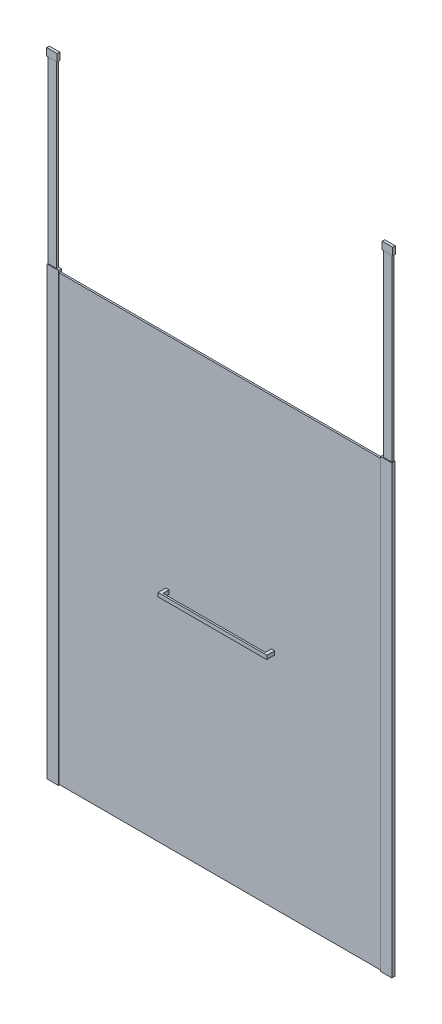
SolidWorks part; units mm, degrees
ref_plane "Płaszczyzna przednia" through (0, 0, 0) normal (0, 0, 1) x (1, 0, 0)
ref_plane "Płaszczyzna górna" through (0, 0, 0) normal (0, 1, 0) x (1, 0, 0)
ref_plane "Płaszczyzna prawa" through (0, 0, 0) normal (1, 0, 0) x (0, 0, -1)
sketch "Szkic1" plane through (0, 0, 0) normal (0, 1, 0) x (1, 0, 0)
  line L0 (0, 0) -> (0, 14)
  line L1 (0, 14) -> (53, 14)
  line L2 (53, 14) -> (53, 11)
  line L3 (53, 11) -> (42.9, 11)
  line L4 (42.9, 11) -> (42.9, 3)
  line L5 (42.9, 3) -> (53, 3)
  line L6 (53, 3) -> (53, 0)
  line L7 (53, 0) -> (0, 0)
  dimension "D1" = 53
  dimension "D2" = 14
  dimension "D3" = 10.1
  dimension "D4" = 3
  dimension "D5" = 8
extrude "Dodanie-wyciągnięcie1" add sketch "Szkic1" along normal blind 2100 from offset 3
sketch "Szkic2" plane through (0, 3, 0) normal (0, -1, 0) x (1, 0, 0)
  line L0 (42.9, -11) -> (53, -11) construction
  line L1 (42.9, -3) -> (1589.9, -3)
  line L2 (42.9, -3) -> (42.9, -11)
  line L3 (42.9, -11) -> (1589.9, -11)
  line L4 (1589.9, -3) -> (1589.9, -11)
  dimension "D1" = 1547
extrude "Dodanie-wyciągnięcie2" add sketch "Szkic2" against normal blind 2100 separate body
sketch "Szkic3" plane through (0, 3, 0) normal (0, -1, 0) x (1, 0, 0)
  line L0 (1579.8, -3) -> (1579.8, 0)
  line L1 (1589.9, -3) -> (42.9, -3) construction
  line L2 (1579.8, 0) -> (1632.8, 0)
  line L3 (1632.8, 0) -> (1632.8, -14)
  line L4 (1632.8, -14) -> (1579.8, -14)
  line L5 (1579.8, -14) -> (1579.8, -11)
  line L6 (1579.8, -11) -> (1589.9, -11)
  line L7 (1589.9, -11) -> (1589.9, -3)
  line L8 (1589.9, -3) -> (1579.8, -3)
  line L9 (42.9, -11) -> (1589.9, -11) construction
  line L10 (1589.9, -11) -> (1589.9, -3) construction
  dimension "D1" = 10.1
  dimension "D2" = 3
  dimension "D3" = 3
  dimension "D4" = 53
extrude "Dodanie-wyciągnięcie3" add sketch "Szkic3" against normal blind 2108 separate body
sketch "Szkic4" plane through (0, 2103, 0) normal (0, 1, 0) x (1, 0, 0)
  line L1 (0, 14) -> (53, 14)
  line L2 (0, 14) -> (0, 0)
  line L3 (0, 0) -> (53, 0)
  line L4 (53, 14) -> (53, 0)
extrude "Dodanie-wyciągnięcie4" add sketch "Szkic4" along normal blind 11
sketch "Szkic5" plane through (0, 2111, 0) normal (0, 1, 0) x (1, 0, 0)
  line L1 (1632.8, 14) -> (1579.8, 14)
  line L2 (1632.8, 14) -> (1632.8, 0)
  line L3 (1632.8, 0) -> (1579.8, 0)
  line L4 (1579.8, 14) -> (1579.8, 0)
extrude "Dodanie-wyciągnięcie5" add sketch "Szkic5" along normal blind 3
sketch "Szkic6" plane through (1579.8, 0, 0) normal (-1, 0, 0) x (0, 0, 1)
  line L0 (-11, 2111) -> (-3, 2111) construction
  line L1 (-2.95, 2111) -> (-11.05, 2111)
  line L2 (-2.95, 2111) -> (-2.95, 2103.2)
  line L3 (-2.95, 2103.2) -> (-11.05, 2103.2)
  line L4 (-11.05, 2111) -> (-11.05, 2103.2)
  point P6 (-7, 2111)
  dimension "D1" = 8.1
  dimension "D2" = 7.8
extrude "Dodanie-wyciągnięcie6" add sketch "Szkic6" against normal blind 15
sketch "Szkic7" plane through (0, 3, 0) normal (0, -1, 0) x (1, 0, 0)
  line L1 (1579.8, 0) -> (1632.8, 0)
  line L2 (1579.8, 0) -> (1579.8, -14)
  line L3 (1579.8, -14) -> (1632.8, -14)
  line L4 (1632.8, 0) -> (1632.8, -14)
extrude "Dodanie-wyciągnięcie7" add sketch "Szkic7" along normal blind 3
sketch "Szkic8" plane through (0, 3, 0) normal (0, -1, 0) x (1, 0, 0)
  line L1 (0, 0) -> (53, 0)
  line L2 (0, 0) -> (0, -14)
  line L3 (0, -14) -> (53, -14)
  line L4 (53, 0) -> (53, -14)
extrude "Dodanie-wyciągnięcie8" add sketch "Szkic8" along normal blind 3
sketch "Szkic9" plane through (0, 2114, 2099.6) normal (0, -1, 0) x (-1, 0, 0)
  line L0 (0, 2113.6) -> (0, 2099.6) construction
  line L1 (-1631.3, 2110.6) -> (-1591.3, 2110.6)
  line L2 (-1631.3, 2110.6) -> (-1631.3, 2102.6)
  line L3 (-1631.3, 2102.6) -> (-1591.3, 2102.6)
  line L4 (-1591.3, 2110.6) -> (-1591.3, 2102.6)
  line L5 (-1.5, 2102.6) -> (-41.5, 2102.6)
  line L6 (-1.5, 2102.6) -> (-1.5, 2110.6)
  line L7 (-1579.8, 2113.6) -> (-1632.8, 2113.6) construction
  line L8 (-1632.8, 2113.6) -> (-1632.8, 2099.6) construction
  line L9 (-1.5, 2110.6) -> (-41.5, 2110.6)
  line L10 (-41.5, 2102.6) -> (-41.5, 2110.6)
  line L11 (-53, 2113.6) -> (0, 2113.6) construction
  dimension "D1" = 3
  dimension "D2" = 1.5
  dimension "D3" = 8
  dimension "D4" = 40
  dimension "D5" = 1.5
  dimension "D6" = 40
  dimension "D7" = 3
  dimension "D8" = 8
extrude "Dodanie-wyciągnięcie9" add sketch "Szkic9" against normal blind 883 separate body
sketch "Szkic10" plane through (0, 2997, 0) normal (0, 1, 0) x (-1, 0, 0)
  line L0 (-1591.3, -3) -> (-1591.3, -11) construction
  line L1 (-1636.3, -0.75) -> (-1586.3, -0.75)
  line L2 (-1636.3, -0.75) -> (-1636.3, -13.25)
  line L3 (-1636.3, -13.25) -> (-1586.3, -13.25)
  line L4 (-1586.3, -0.75) -> (-1586.3, -13.25)
  line L5 (-1636.3, -0.75) -> (-1586.3, -13.25) construction
  line L6 (-1636.3, -13.25) -> (-1586.3, -0.75) construction
  line L8 (-1611.3, -7) -> (-1631.3, -7) construction
  line L9 (-1631.3, -11) -> (-1631.3, -3) construction
  line L10 (-21.5, -11) -> (-21.5, -7) construction
  line L11 (3.5, -13.25) -> (-46.5, -13.25)
  line L12 (3.5, -13.25) -> (3.5, -0.75)
  line L13 (3.5, -0.75) -> (-46.5, -0.75)
  line L14 (-46.5, -13.25) -> (-46.5, -0.75)
  line L15 (3.5, -13.25) -> (-46.5, -0.75) construction
  line L16 (3.5, -0.75) -> (-46.5, -13.25) construction
  line L17 (-1.5, -11) -> (-41.5, -11) construction
  line L18 (-21.5, -7) -> (-1.5, -7) construction
  line L19 (-1.5, -3) -> (-1.5, -11) construction
  point P0 (-1611.3, -7)
  point P9 (-21.5, -7)
  dimension "D1" = 12.5
  dimension "D2" = 50
  dimension "D3" = 50
  dimension "D4" = 12.5
  dimension "D5" = 5
extrude "Dodanie-wyciągnięcie10" add sketch "Szkic10" along normal blind 35 from offset 32
ref_plane "Płaszczyzna1" through (1611.3, 0, 0) normal (1, 0, 0) x (0, 0, -1)
sketch "Szkic12" plane through (0, 0, -3) normal (0, 0, 1) x (1, 0, 0)
  line L0 (816.4, 1409.7928) -> (816.4, 762.3594) construction
  line L1 (566.4, 1053) -> (1066.4, 1053) construction
  line L2 (42.9, 2103) -> (42.9, 3) construction
  line L3 (1589.9, 2103) -> (1589.9, 3) construction
  line L5 (558.9, 1062) -> (573.9, 1062)
  line L6 (558.9, 1062) -> (558.9, 1044)
  line L7 (558.9, 1044) -> (573.9, 1044)
  line L8 (573.9, 1062) -> (573.9, 1044)
  line L9 (558.9, 1062) -> (573.9, 1044) construction
  line L10 (558.9, 1044) -> (573.9, 1062) construction
  line L11 (1058.9, 1062) -> (1073.9, 1062)
  line L12 (1058.9, 1062) -> (1058.9, 1044)
  line L13 (1058.9, 1044) -> (1073.9, 1044)
  line L14 (1073.9, 1062) -> (1073.9, 1044)
  line L15 (1058.9, 1062) -> (1073.9, 1044) construction
  line L16 (1058.9, 1044) -> (1073.9, 1062) construction
  dimension "D1" = 1053
  dimension "D2" = 500
  dimension "D3" = 15
  dimension "D4" = 18
extrude "Dodanie-wyciągnięcie11" add sketch "Szkic12" along normal blind 36.5 and the other way blind 18 separate body
sketch "Szkic13" plane through (573.9, 0, 0) normal (1, 0, 0) x (0, 0, -1)
  line L0 (21, 1044) -> (-33.5, 1044) construction
  line L1 (-33.5, 1062) -> (-25.5, 1062)
  line L2 (-33.5, 1062) -> (-33.5, 1044)
  line L3 (-33.5, 1044) -> (-25.5, 1044)
  line L4 (-25.5, 1062) -> (-25.5, 1044)
  dimension "D1" = 8
extrude "Dodanie-wyciągnięcie12" add sketch "Szkic13" along normal up to surface (485 mm away)
